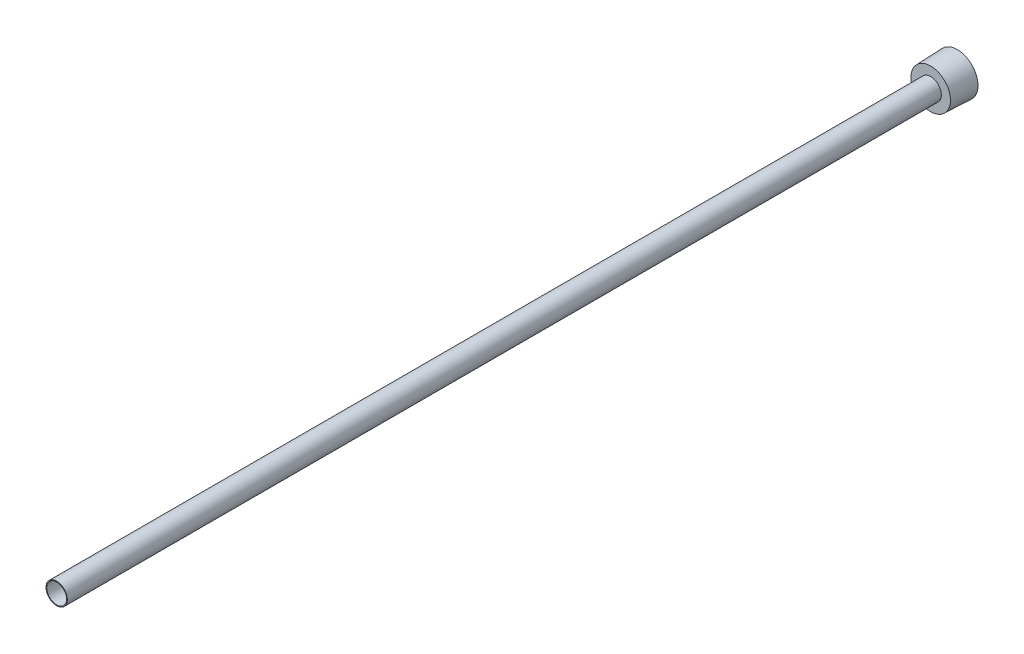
SolidWorks part; units mm, degrees
ref_plane "Front Plane" through (0, 0, 0) normal (0, 0, 1) x (1, 0, 0)
ref_plane "Top Plane" through (0, 0, 0) normal (0, 1, 0) x (1, 0, 0)
ref_plane "Right Plane" through (0, 0, 0) normal (1, 0, 0) x (0, 0, -1)
sketch "Sketch1" plane through (0, 0, 0) normal (1, 0, 0) x (0, 0, -1)
  line L0 (-223.2122, 0) -> (49776.7878, 0) construction
  line L6 (0, 10.541) -> (-13.4874, 10.049)
  line L7 (0, 0) -> (0, 10.541)
  line L8 (-13.4874, 10.049) -> (-13.4874, 5.4229)
  line L9 (-13.4874, 5.4229) -> (-457.2, 5.4229)
  line L10 (-457.2, 5.4229) -> (-457.2, 0)
  line L11 (0, 0) -> (-457.2, 0)
  dimension "D1" = 2.089
  dimension "D2" = 13.4874
  dimension "D3" = 21.082
  dimension "D4" = 10.8458
  dimension "D5" = 457.2
revolve "Revolve1" add sketch "Sketch1" angle 360 about L0
sketch "Sketch2" plane through (0, 0, 457.2) normal (0, 0, 1) x (1, 0, 0)
  circle A0 centre (0, 0) radius 5.0419
  dimension "D1" = 10.0838
extrude "Cut-Extrude1" cut sketch "Sketch2" against normal through all
sketch "Sketch3" plane through (0, 0, 0) normal (0, 0, -1) x (-1, 0, 0)
  line L0 (0, 11.5951) -> (0, -11.5951) construction
  line L1 (0, -7.3323) -> (6.35, -3.6662)
  line L2 (6.35, -3.6662) -> (6.35, 3.6662)
  line L3 (6.35, 3.6662) -> (0, 7.3323)
  line L4 (0, 7.3323) -> (-6.35, 3.6662)
  line L5 (-6.35, 3.6662) -> (-6.35, -3.6662)
  line L6 (-6.35, -3.6662) -> (0, -7.3323)
  circle A0 centre (0, 0) radius 6.35 construction
  dimension "D1" = 12.7
extrude "Cut-Extrude2" cut sketch "Sketch3" against normal blind 9.525
